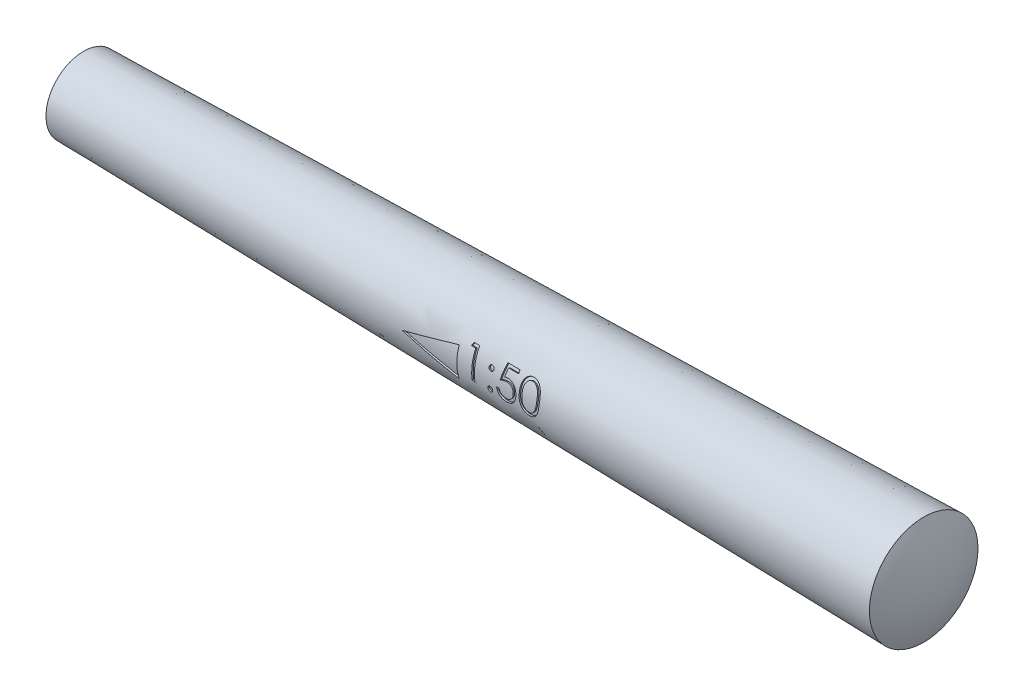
SolidWorks part; units mm, degrees
ref_plane "Front Plane" through (0, 0, 0) normal (0, 0, 1) x (1, 0, 0)
ref_plane "Top Plane" through (0, 0, 0) normal (0, 1, 0) x (1, 0, 0)
ref_plane "Right Plane" through (0, 0, 0) normal (1, 0, 0) x (0, 0, -1)
sketch "Sketch1" plane through (0, 0, 0) normal (1, 0, 0) x (0, 0, -1)
  circle A0 centre (0, 0) radius 1.25
  dimension "D1" = 2.5
extrude "Extrude1" add sketch "Sketch1" along normal mid plane 28
draft "Draft1" type of draft neutral plane draft angle 1.146 faces to draft 1 parameters "D1"=1.146
sketch "Sketch2" plane through (0, 0, 0) normal (0, 0, 1) x (1, 0, 0)
  line L0 (-14, 0) -> (-14, 1.25)
  line L1 (-14, 1.25) -> (-14, -1.25) construction
  line L2 (-14, 0) -> (-14.4, 0)
  line L3 (-14.4, 0) -> (-14.4, -1.53) construction
  line L4 (14, 0) -> (14, 1.81)
  line L5 (14, -1.81) -> (14, 1.81) construction
  line L6 (14, 0) -> (14.4, 0)
  line L7 (14.4, 0) -> (14.4, -1.53) construction
  line L8 (-14, -1.25) -> (14, -1.81) construction
  arc A0 (-14.4, 0) -> (-14, 1.25) centre (-12.2469, 0) cw
  arc A1 (14.4, 0) -> (14, 1.81) centre (10.1048, 0) ccw
  point P14 (0, -1.53)
revolve "Revolve1" add sketch "Sketch2" angle 360 about L2
sketch "Sketch5" plane through (0, 0, 0) normal (0, 0, 1) x (1, 0, 0)
  line L0 (0, 1.53) -> (0, -1.53) construction
  line L1 (14, 1.81) -> (-14, 1.25) construction
  line L2 (-14, -1.25) -> (14, -1.81) construction
ref_plane "Plane2" through (0, 0, 0) normal (-0.02, 0, 0.9998) x (0.9998, 0, 0.02)
sketch "Sketch6" plane through (0, 0, 0) normal (-0.02, 0, 0.9998) x (0.9998, 0, 0.02)
  line L0 (0, 0) -> (0, 0.5)
  line L1 (0, 1.53) -> (0, -1.53) construction
  line L2 (0, 0.5) -> (-1.866, 0)
  line L3 (-1.866, 0) -> (0, -0.5)
  line L4 (0, -0.5) -> (0, 0)
  line L5 (0, -0.25) -> (3, -0.25) construction
  text T0 "1:50" font "Century Gothic" height 1
  dimension "D1" = 1
  dimension "D2" = 30
  dimension "D3" = 3
wrap "Wrap2" sketch "Sketch6" wrap type deboss source sketch "Sketch6" thickness 0.05 parameters "D1"=0.05
equation "\"D2@Sketch2\" = \"D1@Sketch2\""
